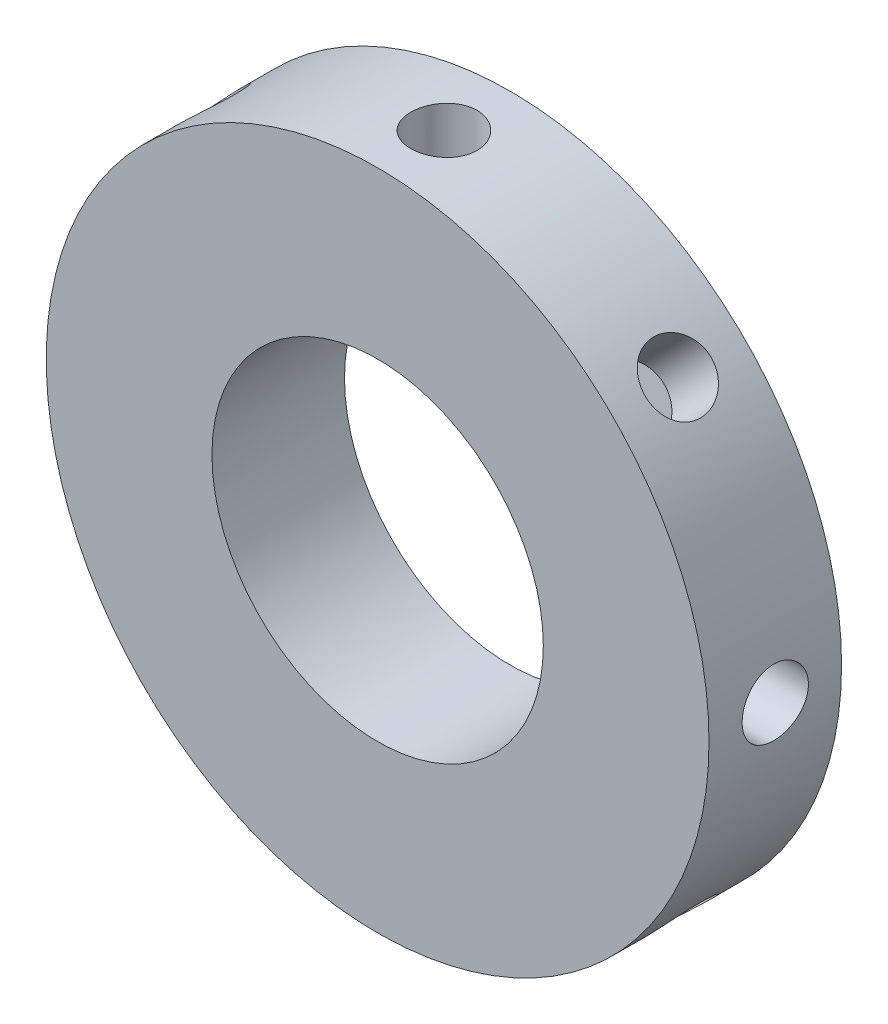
SolidWorks part; units mm, degrees
ref_plane "Alzado" through (0, 0, 0) normal (0, 0, 1) x (1, 0, 0)
ref_plane "Planta" through (0, 0, 0) normal (0, 1, 0) x (1, 0, 0)
ref_plane "Vista lateral" through (0, 0, 0) normal (1, 0, 0) x (0, 0, -1)
sketch "Croquis1" plane through (0, 0, 0) normal (0, 0, 1) x (1, 0, 0)
  circle A0 centre (0, 0) radius 100
  circle A1 centre (0, 0) radius 50
  dimension "D1" = 200
  dimension "D2" = 100
extrude "Saliente-Extruir1" add sketch "Croquis1" along normal blind 40
ref_plane "Plano1" through (100, 0, 0) normal (1, 0, 0) x (0, 0, -1)
sketch "Croquis2" plane through (100, 0, 0) normal (1, 0, 0) x (0, 0, -1)
  line L0 (-20, 100) -> (-20, 0) construction
  line L1 (0, 100) -> (-40, 100) construction
  line L2 (-20, 0) -> (0, 0) construction
  circle A0 centre (-20, 0) radius 10
  dimension "D1" = 20
extrude "Cortar-Extruir1" cut sketch "Croquis2" against normal blind 20
pattern_circular "MatrizC1" count 8 over 360 about axis through (0, 0, 0) along (0, 0, 1) of "Cortar-Extruir1"
